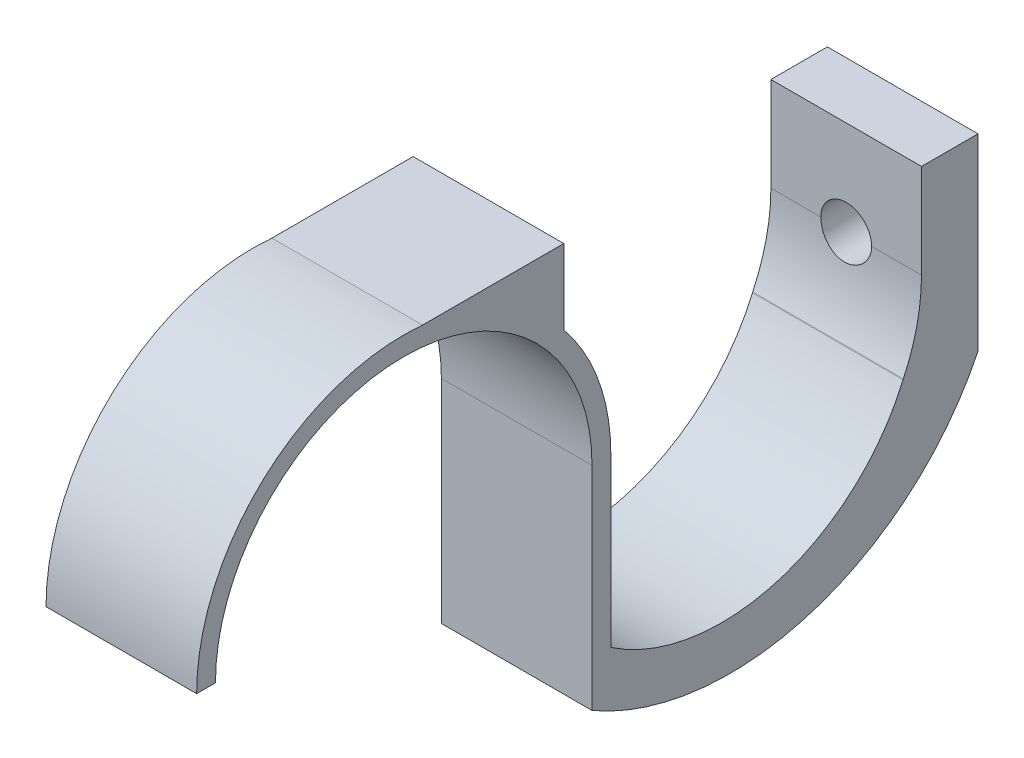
SolidWorks part; units mm, degrees
ref_plane "Front Plane" through (0, 0, 0) normal (0, 0, 1) x (1, 0, 0)
ref_plane "Top Plane" through (0, 0, 0) normal (0, 1, 0) x (1, 0, 0)
ref_plane "Right Plane" through (0, 0, 0) normal (1, 0, 0) x (0, 0, -1)
sketch "Sketch1" plane through (0, 0, 0) normal (1, 0, 0) x (0, 0, -1)
  line L0 (-20.32, 0) -> (20.32, 0) construction
  arc A0 (0, 12.4434) -> (0, -12.4434) centre (-6.35, 0) ccw
  arc A1 (0, -12.4434) -> (0, 12.4434) centre (6.35, 0) ccw
  dimension "D2" = 27.94
  dimension "D3" = 27.94
  dimension "D1" = 40.64
extrude "Boss-Extrude1" add sketch "Sketch1" along normal blind 10.16
sketch "Sketch2" plane through (10.16, 0, 0) normal (1, 0, 0) x (0, 0, -1)
  arc A0 (0, 10.9985) -> (0, -10.9985) centre (-6.35, 0) ccw
  arc A1 (0, -10.9985) -> (0, 10.9985) centre (6.35, 0) ccw
  arc A2 (0, -12.4434) -> (0, 12.4434) centre (6.35, 0) ccw construction
  arc A3 (0, 12.4434) -> (0, -12.4434) centre (-6.35, 0) ccw construction
  dimension "D1" = 1.27
  dimension "D2" = 1.27
extrude "Cut-Extrude1" cut sketch "Sketch2" against normal through all
fillet "Fillet1" radius 1.27 1 edges at (5.08, 10.9985, 0)
fillet "Fillet2" radius 1.27 1 edges at (5.08, -10.9985, 0)
fillet "Fillet3" radius 1.27 1 edges at (5.08, 12.4434, 0)
fillet "Fillet4" radius 1.27 1 edges at (5.08, -12.4434, 0)
sketch "Sketch3" plane through (0, 0, 0) normal (0, 0, 1) x (1, 0, 0)
  line L0 (10.16, -13.97) -> (10.16, 13.97) construction
  line L1 (10.16, -6.35) -> (0, -6.35)
  line L2 (10.16, -6.35) -> (10.16, 6.35)
  line L3 (10.16, 6.35) -> (0, 6.35)
  line L4 (0, -6.35) -> (0, 6.35)
  line L5 (0, 13.97) -> (0, -13.97) construction
  dimension "D1" = 12.7
extrude "Boss-Extrude2" add sketch "Sketch3" along normal up to next from offset 22.86
sketch "Sketch4" plane through (0, 0, -22.86) normal (0, 0, -1) x (-1, 0, 0)
  line L1 (-5.08, 6.35) -> (-5.08, -6.35) construction
  line L2 (-10.16, 6.35) -> (0, 6.35) construction
  line L3 (0, -6.35) -> (-10.16, -6.35) construction
  line L4 (-10.16, 0) -> (0, 0) construction
  circle A0 centre (-5.08, 0) radius 1.7145
  dimension "D1" = 3.429
extrude "Cut-Extrude2" cut sketch "Sketch4" against normal up to next
ref_plane "Plane1" through (0, -6.35, 0) normal (0, 1, 0) x (1, 0, 0)
other "SurfaceCut1"
ref_plane "Plane2" through (0, 1.27, 0) normal (0, 1, 0) x (1, 0, 0)
sketch "Sketch7" plane through (0, 1.27, 0) normal (0, 1, 0) x (1, 0, 0)
  line L0 (0, -0.5292) -> (0, -20.32) construction
  line L1 (0, -20.32) -> (10.16, -20.32)
  line L2 (0, -20.32) -> (0, -12.7)
  line L3 (0, -12.7) -> (10.16, -12.7)
  line L4 (10.16, -20.32) -> (10.16, -12.7)
  line L5 (10.16, -20.32) -> (10.16, -0.5292) construction
  line L6 (0, -20.32) -> (10.16, -20.32) construction
  dimension "D1" = 7.62
surface "Surface-Plane1" sketch "Sketch7"
other "SurfaceCut2"
fillet "Fillet5" radius 0.635 5 edges at (5.08, -6.35, -17.3485) (5.08, 1.27, 18.9863) (5.08, 1.27, 20.2622) (0, 1.27, 19.6242) (10.16, 1.27, 19.6242)
sketch "Sketch9" plane through (0, 0, 0) normal (0, 0, 1) x (1, 0, 0)
  line L1 (-5.3993, 17.4371) -> (14.5818, 17.4371)
  line L2 (-5.3993, 17.4371) -> (-5.3993, -10.5991)
  line L3 (-5.3993, -10.5991) -> (14.5818, -10.5991)
  line L4 (14.5818, 17.4371) -> (14.5818, -10.5991)
extrude "Cut-Extrude3" cut sketch "Sketch9" along normal through all
sketch "Sketch10" plane through (0, 0, 0) normal (1, 0, 0) x (0, 0, -1)
  line L0 (-3.175, -14.3181) -> (-3.175, 0)
  line L1 (-1.905, -11.2701) -> (-1.905, 0)
  line L2 (-28.575, 0) -> (-29.845, 0)
  line L3 (22.86, -6.35) -> (17.8246, -5.4429)
  line L4 (-14.605, 13.9122) -> (-5.08, 13.9122)
  line L5 (-5.08, 13.9122) -> (-5.08, 8.8673)
  circle A1 centre (6.35, 0) radius 12.7 construction
  arc A2 (17.8246, -5.4429) -> (0.5773, 11.3122) centre (6.35, 0) ccw construction
  arc A4 (18.7934, 6.35) -> (0.5292, 12.6996) centre (6.35, 0) ccw construction
  circle A5 centre (6.35, 0) radius 13.97 construction
  arc A6 (22.86, -6.35) -> (-3.175, -14.3181) centre (6.1356, 1.7777) cw
  arc A7 (17.8246, -5.4429) -> (-1.905, -11.2701) centre (5.5671, -0.2554) cw
  arc A8 (-3.175, 0) -> (-28.575, 0) centre (-15.875, 0) ccw
  arc A9 (-1.905, 0) -> (-29.845, 0) centre (-15.875, 0) ccw
  point P31 (-15.875, 13.97)
  dimension "D1" = 15.875
  dimension "D2" = 3.048
  dimension "D3" = 9.525
  dimension "D4" = 1.27
extrude "Boss-Extrude3" add sketch "Sketch10" along normal up to surface (10.16 mm away) contours A9 L5 L4 | L1 A9 L2 A8 L0 A6 L3 A7
sketch "Sketch11" plane through (0, 0, 0) normal (1, 0, 0) x (0, 0, -1)
  line L1 (22.86, 6.35) -> (-1.0978, 6.35)
  line L2 (22.86, 6.35) -> (22.86, 17.7066)
  line L3 (22.86, 17.7066) -> (-1.0978, 17.7066)
  line L4 (-1.0978, 6.35) -> (-1.0978, 17.7066)
extrude "Cut-Extrude4" cut sketch "Sketch11" along normal through all
sketch "Sketch12" plane through (0, 0, 0) normal (1, 0, 0) x (0, 0, -1)
  line L0 (-4.826, 8.9578) -> (-4.826, 13.9122)
  line L1 (22.86, 6.35) -> (17.3485, 6.35)
  line L2 (22.86, 6.35) -> (22.86, 13.97)
  line L5 (-4.826, 13.9122) -> (-14.605, 13.9122)
  line L6 (-14.605, 13.9122) -> (-14.605, 16.4522)
  line L7 (-14.605, 16.4522) -> (22.86, 16.4522)
  line L8 (22.86, 16.4522) -> (22.86, 13.97)
  line L9 (-5.08, 13.9122) -> (-5.08, 8.8673) construction
  circle A0 centre (-15.875, 0) radius 12.7 construction
  arc A1 (17.3485, 6.35) -> (-3.8394, 7.5807) centre (6.35, 0) ccw
  arc A2 (-3.175, 0) -> (-28.575, 0) centre (-15.875, 0) ccw construction
  arc A3 (17.8246, -5.4429) -> (17.3485, 6.35) centre (6.35, 0) ccw construction
  circle A4 centre (-15.875, 0) radius 13.97 construction
  arc A6 (-14.605, 13.9122) -> (-29.845, 0) centre (-15.875, 0) ccw construction
  arc A7 (-4.6014, -8.6734) -> (-3.8394, -7.5807) centre (-15.875, 0) ccw
  arc A8 (-5.5245, -7.3592) -> (-4.6014, -8.6734) centre (6.35, 0) ccw
  arc A9 (-4.7625, -6.1484) -> (-3.8394, -7.5807) centre (6.35, 0) ccw
  arc A10 (-3.8394, 7.5807) -> (-4.826, 8.9578) centre (-15.875, 0) ccw
  dimension "D1" = 0.254
  dimension "D2" = 2.54
  dimension "D3" = 0.254
sketch "Sketch13" plane through (10.16, 0, 0) normal (1, 0, 0) x (0, 0, -1)
  line L0 (19.05, 6.35) -> (17.3485, 6.35)
  line L1 (22.86, 6.35) -> (17.3485, 6.35) construction
  line L2 (19.05, 6.35) -> (19.05, 0)
  arc A0 (17.8246, -5.4429) -> (17.3485, 6.35) centre (6.35, 0) ccw construction
  arc A1 (19.05, 0) -> (17.3485, 6.35) centre (6.35, 0) ccw
  point P0 (19.05, 6.35)
extrude "Cut-Extrude5" cut sketch "Sketch13" against normal through all
